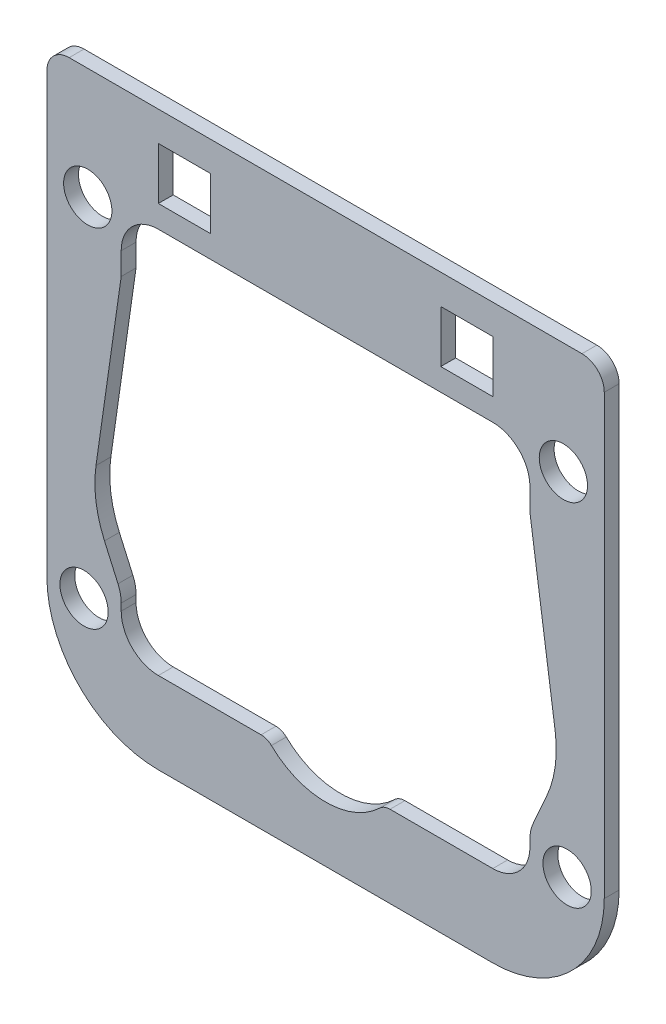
SolidWorks part; units mm, degrees
ref_plane "Plane1" through (0, 0, 0) normal (0, 0, 1) x (1, 0, 0)
ref_plane "Plane2" through (0, 0, 0) normal (0, 1, 0) x (1, 0, 0)
ref_plane "Plane3" through (0, 0, 0) normal (1, 0, 0) x (0, 0, -1)
sketch "Esquisse1" plane through (0, 0, 0) normal (0, 0, 1) x (1, 0, 0)
  line L0 (0, 0) -> (75, 0)
  line L1 (0, 0) -> (0, -62)
  line L2 (60, -77) -> (15, -77)
  line L3 (75, -62) -> (75, 0)
  line L4 (10, -14) -> (65, -14)
  line L5 (10, -14) -> (10, -22)
  line L6 (65, -66) -> (45.3262, -66)
  line L7 (65, -66) -> (65, -59)
  line L8 (37.5, -64) -> (37.5, -81.228) construction
  line L9 (29.6738, -66) -> (10, -66)
  line L10 (0, -62) -> (15, -62) construction
  line L11 (15, -62) -> (15, -80) construction
  line L12 (60, -77) -> (60, -62) construction
  line L13 (60, -62) -> (75, -62) construction
  line L14 (-8, -60) -> (15, -60) construction
  line L15 (-15, -15) -> (26, -15) construction
  line L16 (37.5, -59) -> (37.5, 2.5884) construction
  line L17 (15, -4) -> (22, -4)
  line L18 (15, -4) -> (15, -11)
  line L19 (22, -11) -> (15, -11)
  line L20 (22, -11) -> (22, -4)
  line L21 (53, -11) -> (53, -4)
  line L22 (53, -11) -> (60, -11)
  line L23 (60, -4) -> (60, -11)
  line L24 (60, -4) -> (53, -4)
  line L25 (65, -22) -> (69, -50)
  line L26 (69, -50) -> (65, -59)
  line L27 (65, -22) -> (65, -14)
  line L28 (10, -22) -> (6, -50)
  line L29 (6, -50) -> (10, -59)
  line L30 (10, -59) -> (10, -66)
  arc A0 (29.6738, -66) -> (45.3262, -66) centre (37.5, -59) ccw
  arc A1 (0, -62) -> (15, -77) centre (15, -62) ccw
  arc A2 (60, -77) -> (75, -62) centre (60, -62) ccw
  circle A3 centre (5, -62) radius 3.25
  circle A4 centre (5.5, -15) radius 3.25
  circle A5 centre (70, -62) radius 3.25
  circle A6 centre (69.5, -15) radius 3.25
  dimension "D7" = 21
  dimension "D12" = 6.5
  dimension "D14" = 6.5
  dimension "D1" = 77
  dimension "D2" = 75
  dimension "D3" = 10
  dimension "D4" = 10
  dimension "D5" = 11
  dimension "D6" = 37.5
  dimension "D8" = 18
  dimension "D9" = 15
  dimension "D10" = 15
  dimension "D11" = 60
  dimension "D13" = 15
  dimension "D15" = 7
  dimension "D16" = 7
  dimension "D17" = 11
  dimension "D18" = 15
  dimension "D19" = 14
  dimension "D20" = 6
  dimension "D21" = 27
extrude "Base-Extrusion" add sketch "Esquisse1" along normal blind 2
fillet "Congé1" radius 15
fillet "Congé2" radius 5
fillet "Congé3" radius 5
fillet "Congé4" radius 15
fillet "Congé5" radius 5
fillet "Congé6" radius 2
fillet "Congé7" radius 5
fillet "Congé8" radius 5
fillet "Congé9" radius 3
fillet "Congé10" radius 3
